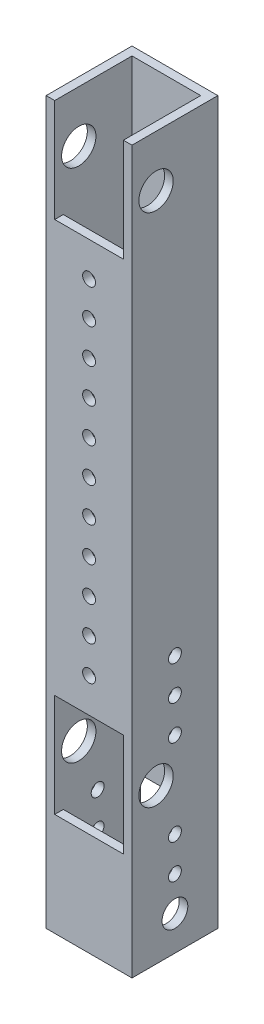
SolidWorks part; units mm, degrees
ref_plane "Front" through (0, 0, 0) normal (0, 0, 1) x (1, 0, 0)
ref_plane "Top" through (0, 0, 0) normal (0, 1, 0) x (1, 0, 0)
ref_plane "Right" through (0, 0, 0) normal (1, 0, 0) x (0, 0, -1)
sketch "Sketch1" plane through (0, 0, 0) normal (0, 1, 0) x (1, 0, 0)
  line L0 (-12.7, 12.7) -> (-15.875, 12.7) construction
  line L1 (15.875, -15.875) -> (-15.875, -15.875)
  line L2 (15.875, -15.875) -> (15.875, 15.875)
  line L3 (15.875, 15.875) -> (-15.875, 15.875)
  line L4 (-15.875, -15.875) -> (-15.875, 15.875)
  line L5 (15.875, -15.875) -> (-15.875, 15.875) construction
  line L6 (15.875, 15.875) -> (-15.875, -15.875) construction
  line L7 (12.7, -12.7) -> (-12.7, -12.7)
  line L8 (12.7, -12.7) -> (12.7, 12.7)
  line L9 (12.7, 12.7) -> (-12.7, 12.7)
  line L10 (-12.7, -12.7) -> (-12.7, 12.7)
  line L11 (12.7, -12.7) -> (-12.7, 12.7) construction
  line L12 (12.7, 12.7) -> (-12.7, -12.7) construction
  line L13 (-12.7, 12.7) -> (-12.7, 15.875) construction
  point P0 (0, 0)
  point P5 (0, 0)
  dimension "D1" = 3.175
  dimension "D2" = 31.75
  dimension "1.25" = 31.75
extrude "Boss-Extrude1" add sketch "Sketch1" along normal blind 266.7
sketch "Sketch2" plane through (15.875, 0, 0) normal (1, 0, 0) x (0, 0, -1)
  line L0 (-15.875, 0) -> (15.875, 0) construction
  line L1 (-12.7, 0) -> (12.7, 0)
  line L2 (-12.7, 0) -> (-12.7, 50.8)
  line L3 (-12.7, 50.8) -> (12.7, 50.8)
  line L4 (12.7, 0) -> (12.7, 50.8)
  line L5 (-15.875, 266.7) -> (-15.875, 0) construction
  dimension "D1" = 3.175
  dimension "D2" = 25.4
  dimension "D3" = 50.8
sketch "Sketch3" plane through (15.875, 0, 0) normal (1, 0, 0) x (0, 0, -1)
  line L1 (-15.875, 266.7) -> (15.875, 266.7) construction
  line L2 (-15.875, 266.7) -> (-15.875, 0) construction
  line L4 (0, 12.7) -> (0, 95.25) construction
  circle A0 centre (-6.985, 247.65) radius 14.2875 construction
  circle A1 centre (-6.985, 247.65) radius 6.35
  circle A2 centre (-6.985, 57.15) radius 6.35
  circle A3 centre (0, 12.7) radius 4.7625
  circle A4 centre (0, 25.4) radius 2.3813
  circle A5 centre (0, 38.1) radius 2.3812
  circle A6 centre (0, 69.85) radius 2.3812
  circle A7 centre (0, 82.55) radius 2.3812
  circle A8 centre (0, 95.25) radius 2.3812
  dimension "D2" = 28.575
  dimension "D3" = 12.7
  dimension "D6" = 190.5
  dimension "D7" = 9.525
  dimension "D9" = 4.7625
  dimension "D12" = 31.75
  dimension "D14" = 12.7
  dimension "D4" = 8.89
  dimension "D5" = 19.05
  dimension "D8" = 12.7
  dimension "D10" = 12.7
  dimension "D11" = 12.7
  dimension "D13" = 12.7
extrude "Cut-Extrude1" cut sketch "Sketch3" against normal through all
sketch "Sketch4" plane through (0, 0, -15.875) normal (0, 0, -1) x (-1, 0, 0)
  line L0 (-15.875, 0) -> (15.875, 0) construction
  line L1 (-12.7, 0) -> (12.7, 0)
  line L2 (-12.7, 0) -> (-12.7, 38.1)
  line L3 (-12.7, 38.1) -> (12.7, 38.1)
  line L4 (12.7, 0) -> (12.7, 38.1)
  line L5 (15.875, 266.7) -> (15.875, 0) construction
  dimension "D1" = 38.1
  dimension "D2" = 25.4
  dimension "D3" = 3.175
extrude "Cut-Extrude2" cut sketch "Sketch4" against normal up to next
sketch "Sketch5" plane through (0, 0, 15.875) normal (0, 0, 1) x (1, 0, 0)
  line L0 (-12.7, 266.7) -> (-12.7, 0) construction
  line L1 (-15.875, 266.7) -> (15.875, 266.7) construction
  line L2 (12.7, 0) -> (12.7, 266.7) construction
  line L3 (-12.7, 266.7) -> (-12.7, 38.1) construction
  line L4 (15.875, 247.65) -> (-15.875, 247.65) construction
  line L5 (15.875, 241.3) -> (15.875, 254) construction
  line L9 (15.875, 50.8) -> (15.875, 63.5) construction
  line L10 (15.875, 241.3) -> (15.875, 254)
  line L11 (15.875, 50.8) -> (15.875, 63.5)
  line L12 (15.875, 57.15) -> (-15.875, 57.15) construction
  line L13 (-15.875, 266.7) -> (-15.875, 0) construction
  line L15 (12.7, 228.6) -> (-12.7, 228.6)
  line L16 (12.7, 228.6) -> (12.7, 266.7)
  line L17 (12.7, 266.7) -> (-12.7, 266.7)
  line L18 (-12.7, 228.6) -> (-12.7, 266.7)
  line L19 (12.7, 228.6) -> (-12.7, 266.7) construction
  line L20 (12.7, 266.7) -> (-12.7, 228.6) construction
  line L21 (12.7, 38.1) -> (-12.7, 38.1)
  line L22 (12.7, 38.1) -> (12.7, 76.2)
  line L23 (12.7, 76.2) -> (-12.7, 76.2)
  line L24 (-12.7, 38.1) -> (-12.7, 76.2)
  line L25 (12.7, 38.1) -> (-12.7, 76.2) construction
  line L26 (12.7, 76.2) -> (-12.7, 38.1) construction
  circle A0 centre (0, 215.9) radius 2.3812
  circle A1 centre (0, 203.2) radius 2.3812
  circle A2 centre (0, 190.5) radius 2.3812
  circle A3 centre (0, 177.8) radius 2.3812
  circle A4 centre (0, 165.1) radius 2.3812
  circle A5 centre (0, 152.4) radius 2.3812
  circle A6 centre (0, 139.7) radius 2.3812
  circle A7 centre (0, 127) radius 2.3813
  circle A8 centre (0, 114.3) radius 2.3812
  circle A9 centre (0, 101.6) radius 2.3812
  circle A10 centre (0, 88.9) radius 2.3812
  point P21 (0, 247.65)
  point P26 (0, 57.15)
  dimension "D3" = 12.7
  dimension "D4" = 4.7625
  dimension "D1" = 38.1
  dimension "D2" = 38.1
  dimension "D5" = 11
extrude "Cut-Extrude3" cut sketch "Sketch5" against normal up to next contours L24 L21 L22 L23 | L18 L15 L16 M3 | A0 | A1 | A2 | A3 | A4 | A10 | A9 | A8 | A7 | A6 | A5
sketch "Sketch6" plane through (0, 0, -15.875) normal (0, 0, -1) x (-1, 0, 0)
  line L0 (0, 88.9) -> (0, 215.9) construction
  line L1 (-8.5725, 88.9) -> (-8.5725, 215.9)
  line L2 (8.5725, 88.9) -> (8.5725, 215.9)
  arc A0 (-8.5725, 88.9) -> (8.5725, 88.9) centre (0, 88.9) ccw
  arc A1 (8.5725, 215.9) -> (-8.5725, 215.9) centre (0, 215.9) ccw
  point P4 (0, 152.4)
  dimension "D1" = 17.145
extrude "Cut-Extrude4" cut sketch "Sketch6" against normal up to next
